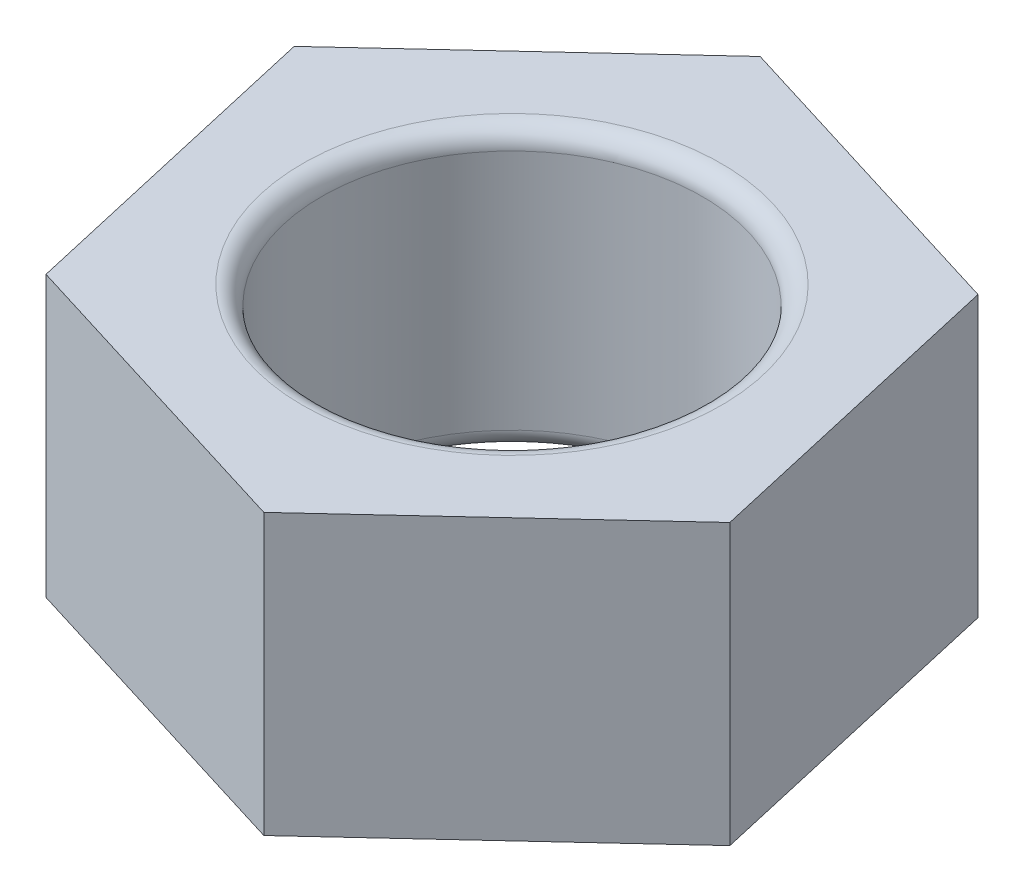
SolidWorks part; units mm, degrees
ref_plane "Front" through (0, 0, 0) normal (0, 0, 1) x (1, 0, 0)
ref_plane "Top" through (0, 0, 0) normal (0, 1, 0) x (1, 0, 0)
ref_plane "Right" through (0, 0, 0) normal (1, 0, 0) x (0, 0, -1)
sketch "Sketch1" plane through (0, 0, 0) normal (0, 1, 0) x (1, 0, 0)
  line L1 (165.5016, -51.0807) -> (126.9879, 117.7882)
  line L2 (126.9879, 117.7882) -> (-38.5136, 168.8689)
  line L3 (-38.5136, 168.8689) -> (-165.5016, 51.0807)
  line L4 (-165.5016, 51.0807) -> (-126.9879, -117.7882)
  line L5 (-126.9879, -117.7882) -> (38.5136, -168.8689)
  line L6 (38.5136, -168.8689) -> (165.5016, -51.0807)
  circle A0 centre (0, 0) radius 100
  circle A1 centre (0, 0) radius 150 construction
  dimension "D1" = 200
  dimension "D2" = 300
extrude "Boss-Extrude1" add sketch "Sketch1" along normal blind 147
fillet "Fillet1" radius 10 2 edges at (0, 147, 100) (0, 0, 100)
